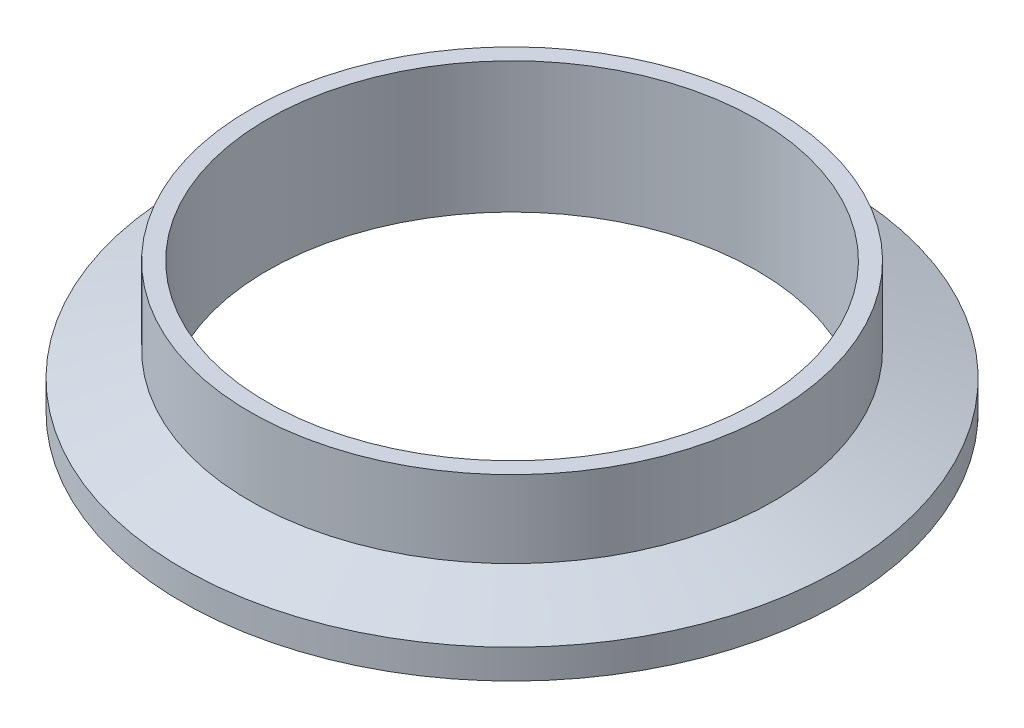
SolidWorks part; units mm, degrees
ref_plane "Front Plane" through (0, 0, 0) normal (0, 0, 1) x (1, 0, 0)
ref_plane "Top Plane" through (0, 0, 0) normal (0, 1, 0) x (1, 0, 0)
ref_plane "Right Plane" through (0, 0, 0) normal (1, 0, 0) x (0, 0, -1)
sketch "Sketch1" plane through (0, 0, 0) normal (0, 0, 1) x (1, 0, 0)
  line L0 (0, 0) -> (0, 12.7) construction
  line L1 (0, 12.7) -> (-25.4, 12.7)
  line L2 (-25.4, 12.7) -> (-25.4, 5.23)
  line L3 (-25.4, 5.23) -> (-31.9532, 2.8448)
  line L4 (-31.9532, 2.8448) -> (-31.9532, 0)
  line L5 (-31.9532, 0) -> (-30.1592, 0)
  line L6 (-26.178, 0) -> (0, 0)
  line L7 (0, 0) -> (0, 12.7)
  line L8 (0, 12.7) -> (-23.749, 12.7)
  line L9 (-23.749, 12.7) -> (-23.749, 0)
  line L10 (-23.749, 0) -> (0, 0)
  line L11 (0, 0) -> (-0.1846, 0.0129)
  line L12 (-29.2675, 0.8729) -> (-29.4344, 0.4797)
  line L13 (-27.0697, 0.8729) -> (-26.9028, 0.4797)
  arc A0 (-29.2675, 0.8729) -> (-27.0697, 0.8729) centre (-28.1686, 0.4064) cw
  arc A1 (-26.178, 0) -> (-26.9028, 0.4797) centre (-26.178, 0.7874) cw
  arc A2 (-30.1592, 0) -> (-29.4344, 0.4797) centre (-30.1592, 0.7874) ccw
  point P12 (-27.0461, 0)
  dimension "D6" = 1.1938
  dimension "D7" = 0.7874
  dimension "D1" = 25.4
  dimension "D3" = 31.9532
  dimension "D4" = 70
  dimension "D5" = 28.1686
  dimension "D8" = 1.651
  dimension "D9" = 12.7
  dimension "D10" = 0.4064
  dimension "D11" = 2.8448
revolve "Revolve2" add sketch "Sketch1" angle 360 about L0
